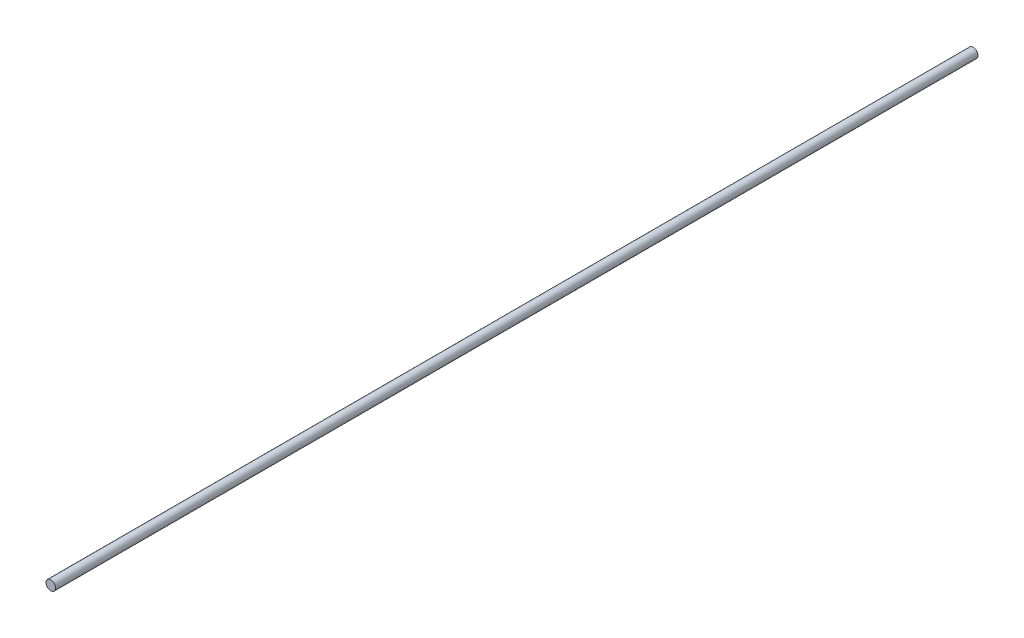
SolidWorks part; units mm, degrees
ref_plane "Front Plane" through (0, 0, 0) normal (0, 0, 1) x (1, 0, 0)
ref_plane "Top Plane" through (0, 0, 0) normal (0, 1, 0) x (1, 0, 0)
ref_plane "Right Plane" through (0, 0, 0) normal (1, 0, 0) x (0, 0, -1)
sketch "Sketch1" plane through (0, 0, 0) normal (0, 0, 1) x (1, 0, 0)
  circle A0 centre (0, 0) radius 30
  dimension "D1" = 60
extrude "Boss-Extrude1" add sketch "Sketch1" against normal blind 5800
